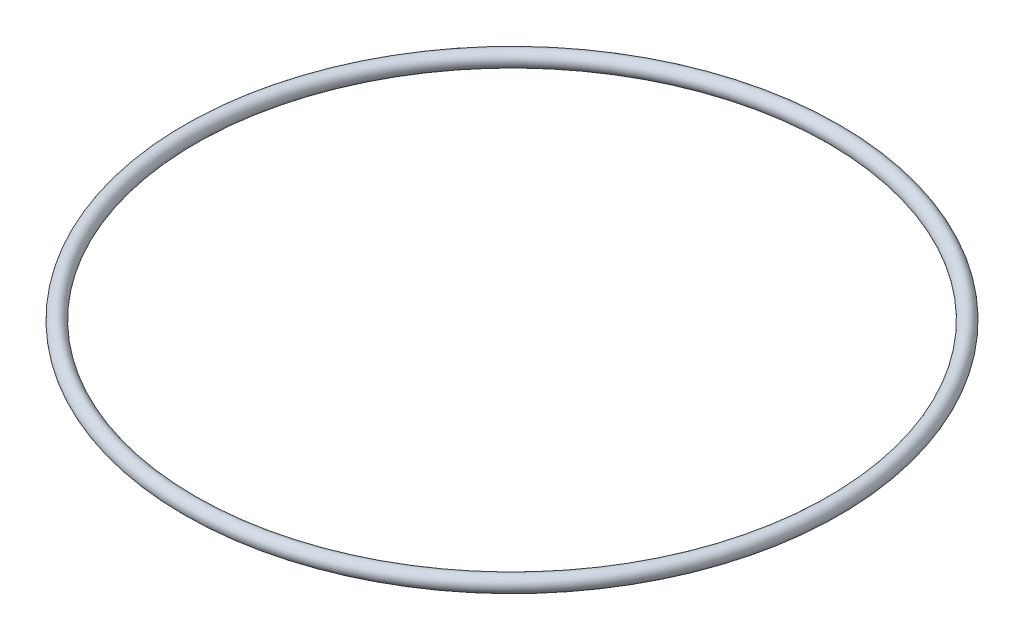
SolidWorks part; units mm, degrees
ref_plane "Plan1" through (0, 0, 0) normal (0, 0, 1) x (1, 0, 0)
ref_plane "Plan2" through (0, 0, 0) normal (0, 1, 0) x (1, 0, 0)
ref_plane "Plan3" through (0, 0, 0) normal (1, 0, 0) x (0, 0, -1)
sketch "Esquisse1" plane through (0, 0, 0) normal (0, 0, 1) x (1, 0, 0)
  line L1 (0, 0) -> (123, 0) construction
  line L2 (0, 1.5) -> (0, -1.5) construction
  circle A0 centre (63, 0) radius 1.5
  dimension "D2" = 63
  dimension "D1" = 3
  dimension "Diamètre du tore" = 3
  dimension "Diamètre intérieur" = 123
revolve "Base-Révolution" add sketch "Esquisse1" angle 360 about L2
equation " \"D1@Esquisse1\"=\"Diamètre du tore@Esquisse1\" "
equation "\"D2@Esquisse1\" = (\"Diamètre intérieur@Esquisse1\"/2)+(\"Diamètre du tore@Esquisse1\"/2)"
